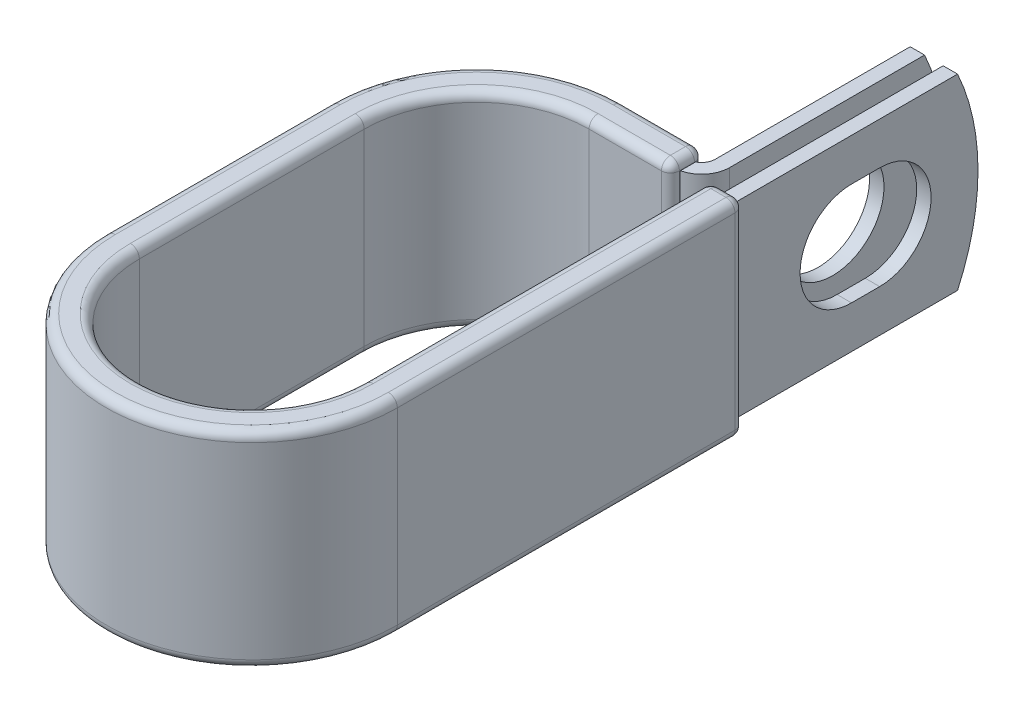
SolidWorks part; units mm, degrees
ref_plane "Front Plane" through (0, 0, 0) normal (0, 0, 1) x (1, 0, 0)
ref_plane "Top Plane" through (0, 0, 0) normal (0, 1, 0) x (1, 0, 0)
ref_plane "Right Plane" through (0, 0, 0) normal (1, 0, 0) x (0, 0, -1)
sketch "Sketch1" plane through (0, 0, 0) normal (0, 1, 0) x (1, 0, 0)
  line L0 (0, 10.3187) -> (6.3665, 10.3187)
  line L1 (10.3187, 0) -> (10.3187, 10.3187)
  line L2 (8.744, 30.9372) -> (8.744, 12.6962)
  line L3 (10.3187, 0) -> (10.3187, -19.05)
  line L4 (-10.3187, 0) -> (-10.3187, -19.05)
  line L5 (10.3187, 10.3187) -> (10.3187, 30.9372)
  arc A0 (0, 10.3187) -> (-10.3187, 0) centre (0, 0) ccw
  arc A1 (-10.3187, -19.05) -> (10.3187, -19.05) centre (0, -19.05) ccw
  arc A3 (6.3665, 10.3187) -> (8.744, 12.6962) centre (6.3665, 12.6962) ccw
extrude "Extrude-Thin1" add sketch "Sketch1" along normal mid plane 15.875 thin
sketch "Sketch2" plane through (7.5248, 0, 0) normal (-1, 0, 0) x (0, 0, 1)
  line L0 (-30.9372, 7.9375) -> (-30.9372, -7.9375) construction
  line L7 (0, 7.9375) -> (0, -7.9375) construction
  circle A0 centre (-21.4122, 0) radius 4.3561
  point P2 (-30.9372, 0)
extrude "Cut-Extrude1" cut sketch "Sketch2" against normal up to surface (1.2192 mm away)
sketch "Sketch3" plane through (11.538, 0, 0) normal (1, 0, 0) x (0, 0, -1)
  line L0 (20.2184, 0) -> (22.606, 0) construction
  line L1 (20.2184, 4.3561) -> (22.606, 4.3561)
  line L2 (20.2184, -4.3561) -> (22.606, -4.3561)
  line L3 (30.9372, 7.9375) -> (30.9372, -7.9375) construction
  arc A0 (20.2184, 4.3561) -> (20.2184, -4.3561) centre (20.2184, 0) ccw
  arc A1 (22.606, -4.3561) -> (22.606, 4.3561) centre (22.606, 0) ccw
  point P3 (21.4122, 0)
  point P8 (30.9372, 0)
  point P11 (15.8623, 0)
  point P12 (26.9621, 0)
extrude "Cut-Extrude2" cut sketch "Sketch3" against normal up to surface (1.2192 mm away)
sketch "Sketch4" plane through (7.5248, 0, 0) normal (-1, 0, 0) x (0, 0, 1)
  line L0 (-30.9372, 7.9375) -> (-30.9372, -7.9375)
  line L1 (-30.9372, 7.9375) -> (-29.2048, 7.9375)
  line L2 (-30.9372, 7.9375) -> (-12.6962, 7.9375) construction
  line L3 (-30.9372, -7.9375) -> (-29.2048, -7.9375)
  line L4 (-30.9372, -7.9375) -> (-12.6962, -7.9375) construction
  arc A0 (-29.2048, 7.9375) -> (-29.2048, -7.9375) centre (-11.8872, 0) ccw
extrude "Cut-Extrude3" cut sketch "Sketch4" against normal through all contours A0 M4 M5 | A0 L0 M2
ref_plane "Plane1" through (0, 0, -10.3187) normal (0, 0, 1) x (1, 0, 0)
ref_plane "Plane2" through (0, 0, 0) normal (-1, 0, 0) x (0, 0, 1)
sketch "Sketch5" plane through (0, 0, -10.3187) normal (0, 0, 1) x (1, 0, 0)
  line L0 (10.3187, 7.9375) -> (11.5379, 7.9375)
  line L1 (10.3188, -7.9375) -> (10.3187, 7.9375)
  line L2 (9.525, -7.9692) -> (9.525, 7.9692)
  line L3 (11.5379, 7.9375) -> (11.538, -7.9375)
  line L4 (11.538, -7.9375) -> (10.3188, -7.9375)
  line L5 (10.287, 8.7312) -> (11.5697, 8.7312)
  line L7 (12.3317, 7.9692) -> (12.3317, -7.9692)
  line L8 (11.5697, -8.7312) -> (10.287, -8.7312)
  line L9 (9.525, -8.7312) -> (9.525, 8.7312) construction
  line L11 (12.3317, -8.7312) -> (9.525, -8.7312) construction
  line L12 (12.3317, 8.7312) -> (12.3317, -8.7312) construction
  line L13 (9.525, 8.7312) -> (12.3317, 8.7312) construction
  arc A0 (9.525, -7.9692) -> (10.287, -8.7312) centre (10.287, -7.9692) ccw
  arc A1 (12.3317, -7.9692) -> (11.5697, -8.7312) centre (11.5697, -7.9692) cw
  arc A2 (11.5697, 8.7312) -> (12.3317, 7.9692) centre (11.5697, 7.9692) cw
  arc A3 (9.525, 7.9692) -> (10.287, 8.7312) centre (10.287, 7.9692) cw
sketch "Sketch6" plane through (0, 7.9375, 0) normal (0, 1, 0) x (1, 0, 0)
  line L0 (9.525, 0) -> (9.525, 10.3187)
  line L1 (9.525, 0) -> (9.525, -19.05)
  line L2 (-9.525, -19.05) -> (-9.525, 0)
  line L3 (0, 9.525) -> (6.8898, 9.525)
  line L4 (7.5248, 29.2048) -> (7.5248, 12.6962) construction
  arc A0 (0, 9.525) -> (-9.525, 0) centre (0, 0) ccw
  arc A1 (-9.525, -19.05) -> (9.525, -19.05) centre (0, -19.05) ccw
sweep "Sweep1" add profiles "Sketch5" path "Sketch6"
fillet "Fillet1" radius 0.762 16 edges at (6.8898, 8.5081, -12.1085) (6.8898, 0, -12.3317) (6.8898, -8.5081, -12.1085) (6.8898, -8.7312, -10.9284) (6.8898, -8.5081, -9.7482) (6.8898, 0, -9.525) (6.8898, 8.5081, -9.7482) (12.1085, 8.5081, -10.3187) (12.3317, 0, -10.3187) (12.1085, -8.5081, -10.3187) (10.9284, -8.7312, -10.3187) (9.7482, -8.5081, -10.3187) (9.525, 0, -10.3187) (9.7482, 8.5081, -10.3187) (6.8898, 8.7312, -10.9284) (10.9284, 8.7312, -10.3187)
equation "\"D4@Sketch5\" = \"D1@Extrude-Thin1\""
equation "\"D5@Sketch5\" = \"D5@Extrude-Thin1\""
equation "\"D1@Sketch3\" = \"D2@Sketch2\""
equation "\"D7@Sketch1\" = \"D3@Sketch2\" + \"D1@Sketch3\""
equation "\"D1@Sketch1\" = \"D1@Sketch6\" + 2 * \"D3@Sketch5\""
equation "\"D1@Sketch4\" = ( \"D1@Extrude-Thin1\" + .125 ) * 2"
equation "\"D2@Sketch1\"=1.95*\"D5@Extrude-Thin1\""
equation "\"D2@Sketch3\" = \"D1@Sketch2\""
equation "\"D2@Sketch6\" = \"D1@Sketch6\""
equation "\"D3@Sketch1\" = \"D1@Sketch6\""
